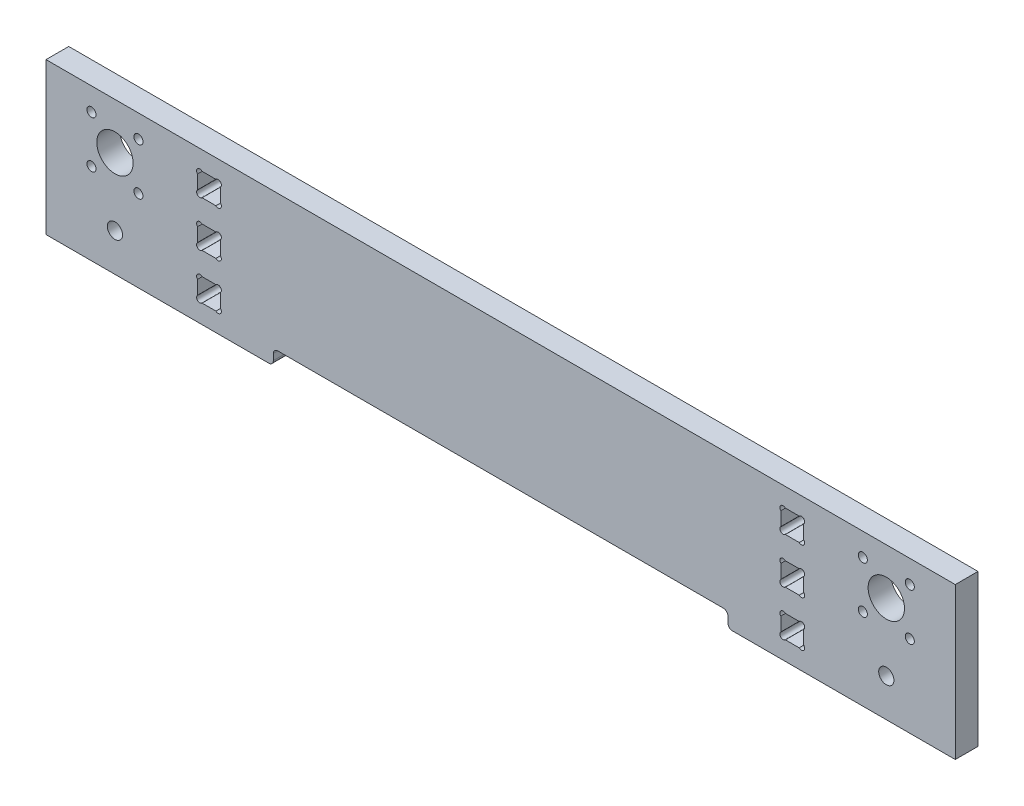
SolidWorks part; units mm, degrees
ref_plane "Ebene vorne" through (0, 0, 0) normal (0, 0, 1) x (1, 0, 0)
ref_plane "Ebene oben" through (0, 0, 0) normal (0, 1, 0) x (1, 0, 0)
ref_plane "Ebene rechts" through (0, 0, 0) normal (1, 0, 0) x (0, 0, -1)
sketch "Skizze1" plane through (0, 0, 0) normal (0, 0, 1) x (1, 0, 0)
  line L0 (600, 0) -> (450, 0)
  line L1 (450, 0) -> (450, 10)
  line L2 (0, 0) -> (0, 100)
  line L3 (0, 100) -> (600, 100)
  line L4 (600, 0) -> (600, 100)
  line L5 (450, 10) -> (150, 10)
  line L6 (150, 10) -> (150, 0)
  line L7 (150, 0) -> (0, 0)
  dimension "D1" = 600
  dimension "D2" = 100
  dimension "D3" = 150
  dimension "D4" = 150
  dimension "D5" = 10
extrude "Aufsatz-Linear austragen1" add sketch "Skizze1" along normal blind 15
sketch "Skizze2" plane through (0, 0, 15) normal (0, 0, 1) x (1, 0, 0)
  line L0 (0, 0) -> (150, 0) construction
  line L1 (500, 45.45) -> (500, 54.55)
  line L2 (497, 57.55) -> (487.9, 57.55)
  line L3 (484.9, 54.55) -> (484.9, 45.45)
  line L4 (487.9, 42.45) -> (497, 42.45)
  line L5 (500, 75.55) -> (500, 84.65)
  line L6 (497, 87.65) -> (487.9, 87.65)
  line L7 (484.9, 84.65) -> (484.9, 75.55)
  line L8 (487.9, 72.55) -> (497, 72.55)
  line L9 (115.1, 45.45) -> (115.1, 54.55)
  line L10 (112.1, 57.55) -> (103, 57.55)
  line L11 (100, 54.55) -> (100, 45.45)
  line L12 (103, 42.45) -> (112.1, 42.45)
  line L13 (600, 100) -> (0, 100) construction
  line L14 (450, 0) -> (600, 0) construction
  line L15 (115.1, 75.55) -> (115.1, 84.65)
  line L16 (500, 15.35) -> (500, 24.45)
  line L17 (112.1, 87.65) -> (103, 87.65)
  line L18 (100, 84.65) -> (100, 75.55)
  line L19 (103, 72.55) -> (112.1, 72.55)
  line L20 (115.1, 15.35) -> (115.1, 24.45)
  line L21 (112.1, 27.45) -> (103, 27.45)
  line L22 (100, 24.45) -> (100, 15.35)
  line L23 (497, 27.45) -> (487.9, 27.45)
  line L24 (484.9, 24.45) -> (484.9, 15.35)
  line L25 (103, 12.35) -> (112.1, 12.35)
  line L26 (487.9, 12.35) -> (497, 12.35)
  line L27 (600, 0) -> (600, 100) construction
  line L29 (0, 100) -> (0, 0) construction
  line L30 (600, 0) -> (600, 100) construction
  line L31 (0, 100) -> (0, 0) construction
  arc A0 (484.9, 15.35) -> (487.9, 12.35) centre (486.4, 13.85) ccw
  arc A1 (484.9, 45.45) -> (487.9, 42.45) centre (486.4, 43.95) ccw
  arc A2 (484.9, 54.55) -> (487.9, 57.55) centre (486.4, 56.05) cw
  arc A3 (497, 42.45) -> (500, 45.45) centre (498.5, 43.95) ccw
  arc A4 (500, 54.55) -> (497, 57.55) centre (498.5, 56.05) ccw
  arc A5 (484.9, 75.55) -> (487.9, 72.55) centre (486.4, 74.05) ccw
  arc A6 (484.9, 84.65) -> (487.9, 87.65) centre (486.4, 86.15) cw
  arc A7 (497, 72.55) -> (500, 75.55) centre (498.5, 74.05) ccw
  arc A8 (500, 84.65) -> (497, 87.65) centre (498.5, 86.15) ccw
  arc A9 (100, 15.35) -> (103, 12.35) centre (101.5, 13.85) ccw
  arc A10 (100, 45.45) -> (103, 42.45) centre (101.5, 43.95) ccw
  arc A11 (100, 54.55) -> (103, 57.55) centre (101.5, 56.05) cw
  arc A12 (484.9, 24.45) -> (487.9, 27.45) centre (486.4, 25.95) cw
  arc A13 (112.1, 42.45) -> (115.1, 45.45) centre (113.6, 43.95) ccw
  arc A14 (497, 12.35) -> (500, 15.35) centre (498.5, 13.85) ccw
  arc A15 (500, 24.45) -> (497, 27.45) centre (498.5, 25.95) ccw
  arc A16 (115.1, 54.55) -> (112.1, 57.55) centre (113.6, 56.05) ccw
  arc A17 (100, 75.55) -> (103, 72.55) centre (101.5, 74.05) ccw
  arc A18 (100, 84.65) -> (103, 87.65) centre (101.5, 86.15) cw
  arc A19 (112.1, 72.55) -> (115.1, 75.55) centre (113.6, 74.05) ccw
  arc A20 (115.1, 84.65) -> (112.1, 87.65) centre (113.6, 86.15) ccw
  arc A21 (100, 24.45) -> (103, 27.45) centre (101.5, 25.95) cw
  arc A22 (112.1, 12.35) -> (115.1, 15.35) centre (113.6, 13.85) ccw
  arc A23 (115.1, 24.45) -> (112.1, 27.45) centre (113.6, 25.95) ccw
  circle A24 centre (539, 85) radius 3
  circle A25 centre (570, 85) radius 3
  circle A26 centre (539, 54) radius 3
  circle A27 centre (570, 54) radius 3
  circle A28 centre (554.5, 69.5) radius 12
  circle A29 centre (554.5, 25) radius 5.025
  circle A30 centre (61, 85) radius 3
  circle A31 centre (45.5, 69.5) radius 12
  circle A32 centre (45.5, 25) radius 5.025
  circle A33 centre (30, 54) radius 3
  circle A34 centre (61, 54) radius 3
  circle A35 centre (30, 85) radius 3
  point P0 (484.9, 12.35)
  point P2 (484.9, 42.45)
  point P4 (500, 57.55)
  point P5 (500, 42.45)
  point P6 (484.9, 57.55)
  point P18 (500, 27.45)
  point P19 (500, 12.35)
  point P21 (484.9, 27.45)
  point P23 (484.9, 72.55)
  point P25 (500, 87.65)
  point P26 (500, 72.55)
  point P27 (484.9, 87.65)
  point P39 (100, 12.35)
  point P41 (100, 42.45)
  point P43 (115.1, 57.55)
  point P44 (115.1, 42.45)
  point P45 (100, 57.55)
  point P59 (115.1, 27.45)
  point P60 (115.1, 12.35)
  point P62 (100, 27.45)
  point P64 (100, 72.55)
  point P66 (115.1, 87.65)
  point P67 (115.1, 72.55)
  point P68 (100, 87.65)
  dimension "D12" = 15.1
  dimension "D13" = 2.1213
  dimension "D14" = 9.1
  dimension "D15" = 3
  dimension "D10" = 15.1
  dimension "D11" = 15.1
  dimension "D17" = 3
  dimension "D21" = 6
  dimension "D22" = 6
  dimension "D23" = 6
  dimension "D24" = 6
  dimension "D29" = 24
  dimension "D32" = 10.05
  dimension "D33" = 9.1
  dimension "D34" = 6
  dimension "D35" = 6
  dimension "D38" = 24
  dimension "D39" = 10.05
  dimension "D48" = 15.1
  dimension "D49" = 9.1
  dimension "D50" = 3
  dimension "D51" = 3
  dimension "D16" = 2.1213
  dimension "D72" = 2.1213
  dimension "D73" = 9.1
  dimension "D74" = 9.1
  dimension "D115" = 3
  dimension "D116" = 3
  dimension "D117" = 3
  dimension "D118" = 15.1
  dimension "D119" = 15.1
  dimension "D120" = 2.1213
  dimension "D121" = 2.1213
  dimension "D122" = 2.1213
  dimension "D123" = 2.1213
  dimension "D124" = 3
  dimension "D125" = 15.1
  dimension "D126" = 15.1
  dimension "D5" = 2.1213
  dimension "D60" = 2.1213
  dimension "D61" = 2.1213
  dimension "D62" = 2.1213
  dimension "D63" = 2.1213
  dimension "D81" = 2.1213
  dimension "D82" = 2.1213
  dimension "D83" = 2.1213
  dimension "D84" = 2.1213
  dimension "D102" = 2.1213
  dimension "D103" = 2.1213
  dimension "D104" = 2.1213
  dimension "D139" = 2.1213
  dimension "D140" = 2.1213
  dimension "D141" = 2.1213
  dimension "D142" = 2.1213
  dimension "D148" = 6
  dimension "D149" = 6
  dimension "D6" = 25
  dimension "D7" = 25
  dimension "D8" = 15.1
  dimension "D9" = 15.1
  dimension "D18" = 3
  dimension "D19" = 15.1
  dimension "D20" = 15.1
  dimension "D25" = 31
  dimension "D26" = 31
  dimension "D27" = 15.5
  dimension "D28" = 15.5
  dimension "D30" = 15
  dimension "D31" = 30
  dimension "D36" = 31
  dimension "D37" = 15.5
  dimension "D40" = 30
  dimension "D41" = 15
  dimension "D42" = 9.1
  dimension "D43" = 9.1
  dimension "D44" = 3
  dimension "D45" = 3
  dimension "D46" = 3
  dimension "D47" = 12.35
  dimension "D52" = 9.1
  dimension "D53" = 9.1
  dimension "D54" = 9.1
  dimension "D55" = 3
  dimension "D56" = 3
  dimension "D57" = 3
  dimension "D58" = 15.1
  dimension "D59" = 15.1
  dimension "D64" = 3
  dimension "D65" = 15.1
  dimension "D66" = 15.1
  dimension "D67" = 15.1
  dimension "D68" = 9.1
  dimension "D69" = 3
  dimension "D70" = 3
  dimension "D71" = 100
  dimension "D75" = 9.1
  dimension "D76" = 3
  dimension "D77" = 3
  dimension "D78" = 3
  dimension "D79" = 15.1
  dimension "D80" = 15.1
  dimension "D85" = 3
  dimension "D86" = 15
  dimension "D87" = 15
  dimension "D88" = 15.1
  dimension "D89" = 15.1
  dimension "D90" = 15.1
  dimension "D91" = 9.1
  dimension "D92" = 3
  dimension "D93" = 3
  dimension "D94" = 9.1
  dimension "D95" = 9.1
  dimension "D96" = 9.1
  dimension "D97" = 3
  dimension "D98" = 3
  dimension "D99" = 3
  dimension "D100" = 15.1
  dimension "D101" = 15.1
  dimension "D105" = 3
  dimension "D106" = 15.1
  dimension "D107" = 15.1
  dimension "D108" = 15.1
  dimension "D109" = 9.1
  dimension "D110" = 3
  dimension "D111" = 3
  dimension "D112" = 9.1
  dimension "D113" = 9.1
  dimension "D114" = 9.1
  dimension "D127" = 15.1
  dimension "D128" = 9.1
  dimension "D129" = 3
  dimension "D130" = 3
  dimension "D131" = 9.1
  dimension "D132" = 9.1
  dimension "D133" = 9.1
  dimension "D134" = 3
  dimension "D135" = 3
  dimension "D136" = 3
  dimension "D137" = 15.1
  dimension "D138" = 15.1
  dimension "D143" = 3
  dimension "D144" = 15
  dimension "D145" = 100
  dimension "D146" = 12.35
  dimension "D147" = 15
extrude "Schnitt-Linear austragen1" cut sketch "Skizze2" against normal blind 15 contours L5 A8 L6 A6 L7 A5 L8 A7 | L15 A20 L17 A18 L18 A17 L19 A19 | L9 A16 L10 A11 L11 A10 L12 A13 | L20 A23 L21 A21 L22 A9 L25 A22
sketch "Skizze4" plane through (0, 0, 15) normal (0, 0, 1) x (1, 0, 0)
  circle A0 centre (554.5, 25) radius 5.025
  circle A1 centre (45.5, 25) radius 5.025
extrude "Schnitt-Linear austragen2" cut sketch "Skizze4" against normal blind 7.5
fillet "Verrundung1" radius 3 4 edges at (450, 0, 7.5) (450, 10, 7.5) (150, 10, 7.5) (150, 0, 7.5)
